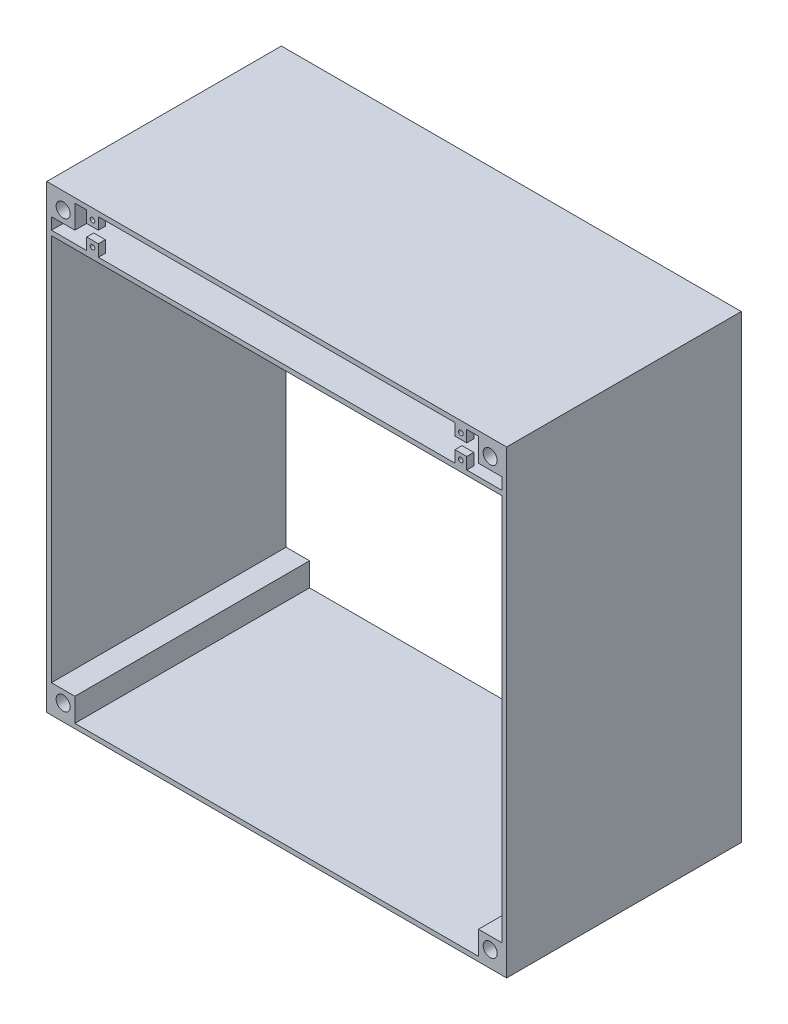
SolidWorks part; units mm, degrees
ref_plane "Front Plane" through (0, 0, 0) normal (0, 0, 1) x (1, 0, 0)
ref_plane "Top Plane" through (0, 0, 0) normal (0, 1, 0) x (1, 0, 0)
ref_plane "Right Plane" through (0, 0, 0) normal (1, 0, 0) x (0, 0, -1)
sketch "Sketch1" plane through (0, 0, 0) normal (0, 0, 1) x (1, 0, 0)
  line L0 (0, 248.92) -> (248.92, 248.92)
  line L1 (-2.54, -2.54) -> (251.46, -2.54)
  line L2 (-2.54, -2.54) -> (-2.54, 251.46)
  line L3 (-2.54, 251.46) -> (251.46, 251.46)
  line L4 (251.46, -2.54) -> (251.46, 251.46)
  line L5 (248.92, 0) -> (248.92, 248.92)
  line L6 (0, 0) -> (248.92, 0)
  line L7 (0, 0) -> (0, 248.92)
  line L8 (2.54, 246.38) -> (246.38, 246.38)
  line L9 (246.38, 2.54) -> (246.38, 246.38)
  line L10 (2.54, 2.54) -> (246.38, 2.54)
  line L11 (2.54, 2.54) -> (2.54, 246.38)
  dimension "D1" = 254
  dimension "D2" = 254
  dimension "D3" = 2.54
  dimension "D4" = 2.54
extrude "Boss-Extrude1" add sketch "Sketch1" along normal mid plane 127 contours L7 L6 L5 L0 L10 L11 L8 L9
sketch "Sketch2" plane through (0, 0, 0) normal (0, 0, 1) x (1, 0, 0)
  line L0 (246.38, 2.54) -> (246.38, 246.38) construction
  line L1 (2.54, 246.38) -> (246.38, 246.38)
  line L2 (2.54, 246.38) -> (2.54, 227.33)
  line L3 (2.54, 227.33) -> (246.38, 227.33)
  line L4 (246.38, 246.38) -> (246.38, 227.33)
  line L6 (2.54, 227.33) -> (246.38, 227.33)
  line L7 (2.54, 227.33) -> (2.54, 224.79)
  line L8 (2.54, 224.79) -> (246.38, 224.79)
  line L9 (246.38, 227.33) -> (246.38, 224.79)
  dimension "D1" = 19.05
  dimension "D2" = 2.54
extrude "Extrude-Thin1" add sketch "Sketch2" along normal mid plane 127 thin contours L7 L8 L9
sketch "Sketch4" plane through (0, 224.79, 0) normal (0, -1, 0) x (1, 0, 0)
  line L0 (0, 0) -> (248.92, 0) construction
  line L1 (248.92, 63.5) -> (248.92, -63.5) construction
  line L2 (2.54, 63.5) -> (2.54, -63.5) construction
  line L3 (246.38, 63.5) -> (246.38, -63.5) construction
  circle A0 centre (63.5, 0) radius 6.35
  circle A1 centre (185.42, 0) radius 6.35
  dimension "D3" = 12.7
  dimension "D4" = 12.7
  dimension "D1" = 60.96
  dimension "D2" = 60.96
extrude "Cut-Extrude1" cut sketch "Sketch4" against normal blind 2.54 contours A0 | A1
sketch "Sketch5" plane through (0, 0, 63.5) normal (0, 0, 1) x (1, 0, 0)
  line L0 (21.59, 227.33) -> (21.59, 233.68)
  line L1 (246.38, 227.33) -> (2.54, 227.33) construction
  line L2 (21.59, 233.68) -> (27.94, 233.68)
  line L3 (27.94, 233.68) -> (27.94, 227.33)
  line L4 (124.46, 246.38) -> (124.46, 185.7467) construction
  line L5 (2.54, 246.38) -> (246.38, 246.38) construction
  line L6 (220.98, 233.68) -> (220.98, 227.33)
  line L7 (227.33, 233.68) -> (220.98, 233.68)
  line L8 (227.33, 227.33) -> (227.33, 233.68)
  line L9 (2.54, 236.855) -> (142.3624, 236.855) construction
  line L10 (2.54, 227.33) -> (2.54, 246.38) construction
  line L11 (227.33, 246.38) -> (227.33, 240.03)
  line L12 (227.33, 240.03) -> (220.98, 240.03)
  line L13 (220.98, 240.03) -> (220.98, 246.38)
  line L14 (27.94, 240.03) -> (27.94, 246.38)
  line L15 (21.59, 240.03) -> (27.94, 240.03)
  line L16 (21.59, 246.38) -> (21.59, 240.03)
  circle A0 centre (24.765, 230.505) radius 1.27
  circle A1 centre (224.155, 230.505) radius 1.27
  circle A2 centre (224.155, 243.205) radius 1.27
  circle A3 centre (24.765, 243.205) radius 1.27
  point P18 (24.765, 233.68)
  point P20 (21.59, 230.505)
  dimension "D4" = 2.54
  dimension "D1" = 6.35
  dimension "D2" = 6.35
  dimension "D3" = 19.05
extrude "Boss-Extrude2" add sketch "Sketch5" against normal blind 3.81 contours L8 L7 L6 M3 | L3 L2 L0 M3 | L13 L12 L11 A2 M5 | L16 L15 L14 A3 M5
mirror "Mirror1" about plane through (0, 0, 0) normal (0, 0, 1) of "Boss-Extrude2"
sketch "Sketch6" plane through (0, 0, 0) normal (0, 0, 1) x (1, 0, 0)
  line L0 (124.46, 2.54) -> (124.46, 104.3744) construction
  line L1 (2.54, 2.54) -> (15.24, 2.54)
  line L2 (2.54, 2.54) -> (2.54, 15.24)
  line L3 (2.54, 15.24) -> (15.24, 15.24)
  line L4 (15.24, 2.54) -> (15.24, 15.24)
  line L5 (2.54, 2.54) -> (246.38, 2.54) construction
  line L6 (233.68, 2.54) -> (233.68, 15.24)
  line L7 (246.38, 15.24) -> (233.68, 15.24)
  line L8 (246.38, 2.54) -> (246.38, 15.24)
  line L9 (246.38, 2.54) -> (233.68, 2.54)
  line L10 (248.92, 124.46) -> (118.39, 124.46) construction
  line L11 (248.92, 0) -> (248.92, 248.92) construction
  line L12 (246.38, 246.38) -> (233.68, 246.38)
  line L13 (246.38, 246.38) -> (246.38, 233.68)
  line L14 (246.38, 233.68) -> (233.68, 233.68)
  line L15 (233.68, 246.38) -> (233.68, 233.68)
  line L16 (15.24, 246.38) -> (15.24, 233.68)
  line L17 (2.54, 233.68) -> (15.24, 233.68)
  line L18 (2.54, 246.38) -> (2.54, 233.68)
  line L19 (2.54, 246.38) -> (15.24, 246.38)
  circle A0 centre (8.89, 8.89) radius 3.81
  circle A1 centre (240.03, 8.89) radius 3.81
  circle A2 centre (240.03, 240.03) radius 3.81
  circle A3 centre (8.89, 240.03) radius 3.81
  point P8 (8.89, 15.24)
  point P10 (15.24, 8.89)
  dimension "D1" = 7.62
  dimension "D2" = 12.7
  dimension "D3" = 12.7
extrude "Boss-Extrude3" add sketch "Sketch6" along normal mid plane 127 contours L12 L15 L14 L13 A2 | L1 L4 L3 L2 A0 | L9 L8 L7 L6 A1 | L19 L18 L17 L16 A3
